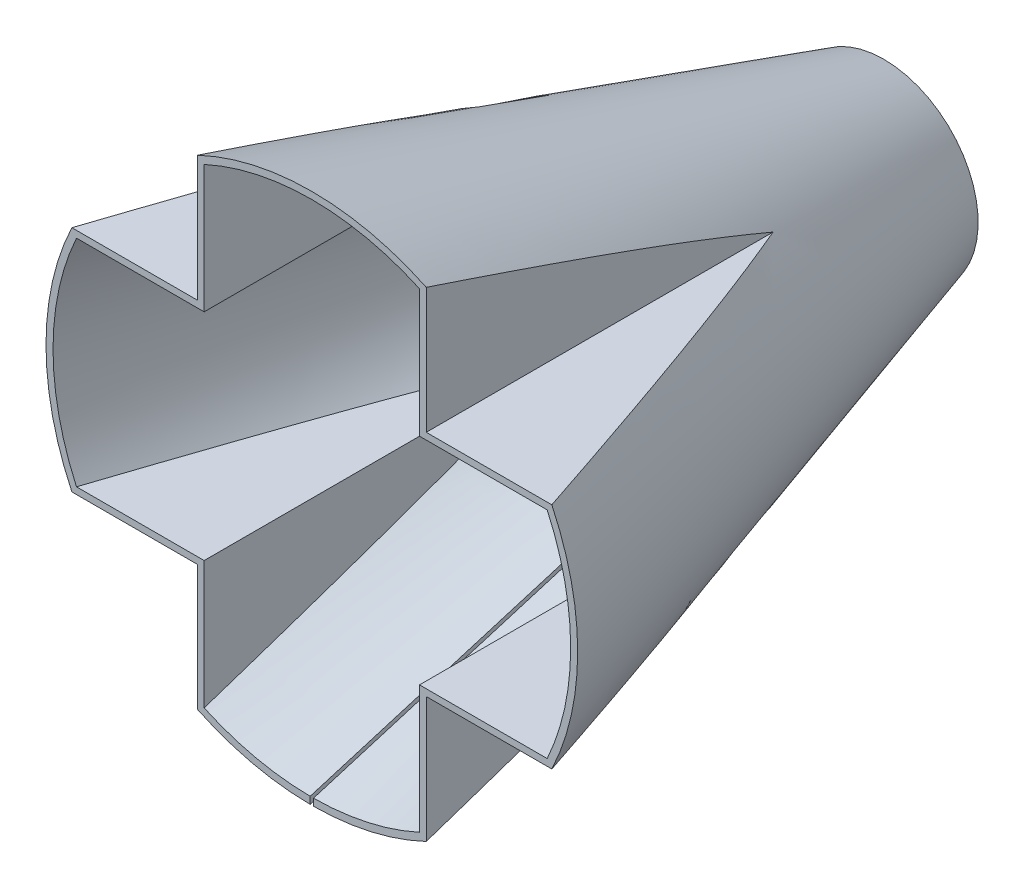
SolidWorks part; units mm, degrees
ref_plane "Alzado" through (0, 0, 0) normal (0, 0, 1) x (1, 0, 0)
ref_plane "Planta" through (0, 0, 0) normal (0, 1, 0) x (1, 0, 0)
ref_plane "Vista lateral" through (0, 0, 0) normal (1, 0, 0) x (0, 0, -1)
sketch "Croquis1" plane through (0, 0, 0) normal (0, 1, 0) x (1, 0, 0)
  line L0 (0, 0) -> (39.5, 0)
  line L1 (0, 0) -> (0, 85)
  line L2 (0, 85) -> (14, 85)
  line L3 (14, 85) -> (39.5, 0)
revolve "Revolución1" add sketch "Croquis1" angle 360 about L1
sketch "Croquis2" plane through (0, 0, 0) normal (0, 0, 1) x (1, 0, 0)
  line L0 (0, 59.7491) -> (0, -40) construction
  line L1 (-57.1256, 0) -> (54.018, 0) construction
  line L6 (-17, 35.7211) -> (-17, 17)
  line L7 (-35.7211, -17) -> (-17, -17)
  line L8 (17, 35.7211) -> (17, 17)
  line L9 (-35.7211, 17) -> (-17, 17)
  line L10 (-17, 59.7491) -> (-17, -55.4187) construction
  line L11 (-57.1256, 17) -> (54.018, 17) construction
  line L12 (-17, -17) -> (-17, -35.7211)
  line L13 (17, 17) -> (35.7211, 17)
  line L14 (17, -17) -> (17, -35.7211)
  line L15 (17, 59.7491) -> (17, -55.4187) construction
  line L16 (17, -17) -> (35.7211, -17)
  line L17 (-57.1256, -17) -> (54.018, -17) construction
  line L18 (0, 59.7491) -> (0, -55.4187) construction
  arc A8 (-17, 35.7211) -> (-35.7211, 17) centre (0, 0) ccw
  arc A9 (-35.7211, -17) -> (-17, -35.7211) centre (0, 0) ccw
  arc A10 (35.7211, 17) -> (17, 35.7211) centre (0, 0) ccw
  arc A11 (17, -35.7211) -> (35.7211, -17) centre (0, 0) ccw
  dimension "D1" = 17
  dimension "D2" = 17
extrude "Cortar-Extruir2" cut sketch "Croquis2" against normal blind 100
shell "Vaciado1" thickness 1
sketch "Croquis3" plane through (0, 0, 0) normal (0, 1, 0) x (1, 0, 0)
  line L0 (0, -14.5527) -> (0, 99.8948) construction
  line L1 (0.25, -14.5527) -> (0.25, 99.8948)
  line L2 (-0.25, -14.5527) -> (-0.25, 99.8948)
  line L3 (-0.25, 99.8948) -> (0.25, 99.8948)
  line L4 (-0.25, -14.5527) -> (0.25, -14.5527)
  dimension "D1" = 0.25
  dimension "D2" = 0.25
extrude "Cortar-Extruir3" cut sketch "Croquis3" against normal blind 90
